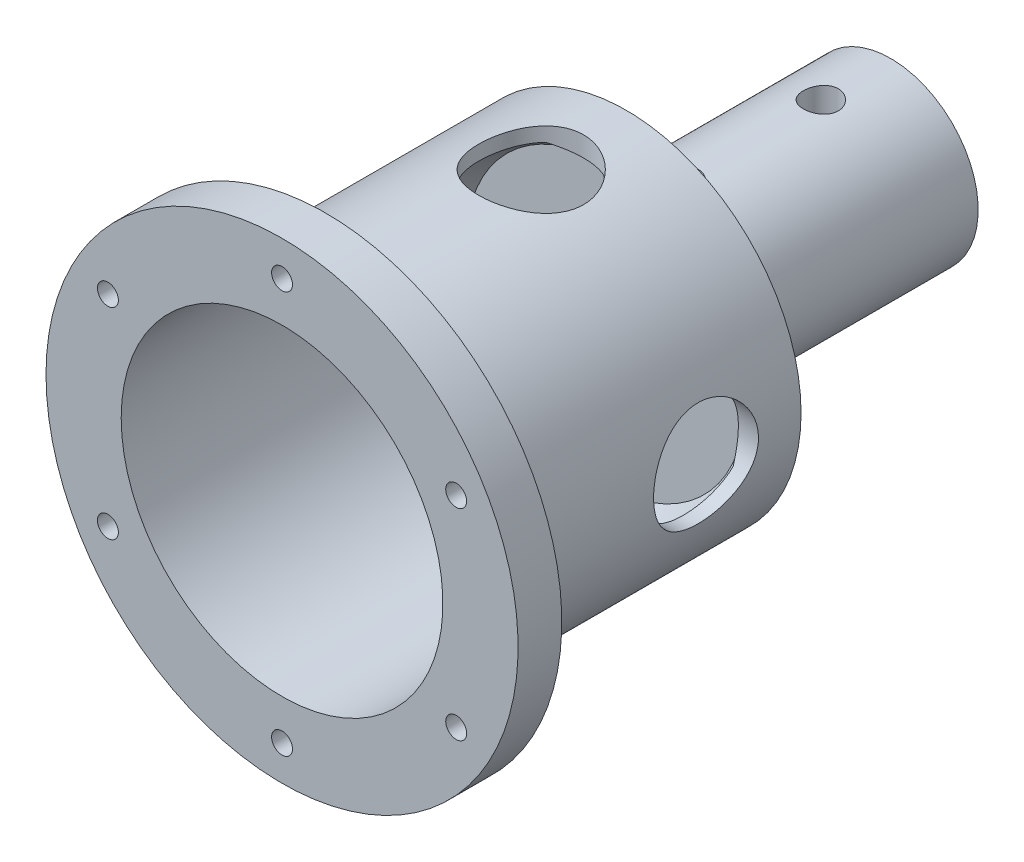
SolidWorks part; units mm, degrees
ref_plane "Front" through (0, 0, 0) normal (0, 0, 1) x (1, 0, 0)
ref_plane "Top" through (0, 0, 0) normal (0, 1, 0) x (1, 0, 0)
ref_plane "Right" through (0, 0, 0) normal (1, 0, 0) x (0, 0, -1)
sketch "Sketch1" plane through (0, 0, 0) normal (1, 0, 0) x (0, 0, -1)
  line L0 (0, 29.21) -> (53.175, 29.21)
  line L1 (53.175, 29.21) -> (58.7375, 25.3151)
  line L2 (58.7375, 25.3151) -> (58.7375, 8.7313)
  line L3 (0, 29.21) -> (0, 42.8625)
  line L4 (0, 42.8625) -> (7.9375, 42.8625)
  line L5 (7.9375, 42.8625) -> (7.9375, 31.75)
  line L6 (7.9375, 31.75) -> (62.5, 31.75)
  line L7 (62.5, -15.875) -> (110.534, -15.875) construction
  line L8 (110.534, 15.875) -> (110.534, 8.7313)
  line L9 (110.534, 8.7313) -> (58.7375, 8.7313)
  line L10 (0, 0) -> (-25.3858, 0) construction
  line L11 (0, -29.21) -> (53.175, -29.21) construction
  line L12 (7.9375, -31.75) -> (62.5, -31.75) construction
  line L13 (0, -42.8625) -> (7.9375, -42.8625) construction
  line L14 (110.534, -8.7312) -> (58.7375, -8.7312) construction
  line L15 (62.5, 31.75) -> (62.5, 15.875)
  line L16 (62.5, 15.875) -> (110.534, 15.875)
  dimension "D1" = 58.42
  dimension "D2" = 53.175
  dimension "D3" = 63.5
  dimension "D4" = 35
  dimension "D5" = 58.7375
  dimension "D6" = 110.534
  dimension "D7" = 31.75
  dimension "D8" = 85.725
  dimension "D9" = 17.4625
  dimension "D10" = 62.5
  dimension "D11" = 7.9375
revolve "Revolve1" add sketch "Sketch1" angle 360 about L10
sketch "Sketch2" plane through (0, 0, -110.534) normal (0, 0, -1) x (-1, 0, 0)
  circle A0 centre (0, 0) radius 10.9004
  dimension "D1" = 21.8008
extrude "Extrude1" cut sketch "Sketch2" against normal blind 48.304
sketch "Sketch3" plane through (0, 0, 0) normal (1, 0, 0) x (0, 0, -1)
  circle A0 centre (45.2438, 0) radius 9.525
  dimension "D1" = 19.05
  dimension "D2" = 45.2438
extrude "Cut-Extrude1" cut sketch "Sketch3" against normal through all and the other way through all
sketch "Sketch4" plane through (0, 0, 0) normal (0, 1, 0) x (1, 0, 0)
  circle A0 centre (0, 45.2438) radius 9.525
  dimension "D1" = 19.05
  dimension "D2" = 45.2438
extrude "Extrude2" cut sketch "Sketch4" against normal through all and the other way through all
hole_wizard "CBORE for #6 Socket Head Cap Screw1" positions "Sketch6" profile "Sketch5" counterbore size "#6" standard "Ansi Inch"
sketch "Sketch6" plane through (0, 0, -7.9375) normal (0, 0, -1) x (-1, 0, 0)
  circle A0 centre (0, 0) radius 36.5125 construction
  point P0 (0, 36.5125)
  point P14 (31.6208, 18.2563)
  point P15 (31.6208, -18.2562)
  point P16 (0, -36.5125)
  point P17 (-31.6208, -18.2563)
  point P18 (-31.6208, 18.2563)
  dimension "D1" = 73.025
sketch "Sketch5" plane through (0, 36.5125, -7.9375) normal (1, 0, 0) x (0, 1, 0)
  line L0 (0, 0) -> (0, 7.9375)
  line L1 (0, 7.9375) -> (1.8986, 7.9375)
  line L3 (1.8986, 7.9375) -> (1.8986, 3.5052)
  line L4 (1.8986, 3.5052) -> (3.5725, 3.5052)
  line L5 (3.5725, 3.5052) -> (3.5725, 0)
  line L7 (3.5725, 0) -> (0, 0)
  line L11 (0, -6.35) -> (0, 107.95) construction
  dimension "Thru Hole Dia." = 3.7973
  dimension "Thru Hole Depth" = 7.9375
  dimension "C'Bore Dia." = 7.145
  dimension "C'Bore Depth" = 3.5052
sketch "Sketch7" plane through (0, 0, 0) normal (1, 0, 0) x (0, 0, -1)
  line L0 (110.534, 10.9004) -> (62.23, 10.9004) construction
  line L1 (109.3226, 10.9004) -> (108.2226, 10.9004)
  line L2 (109.3226, 10.9004) -> (109.3226, 11.5)
  line L3 (109.3226, 11.5) -> (108.2226, 11.5)
  line L4 (108.2226, 10.9004) -> (108.2226, 11.5)
  line L5 (0, 0) -> (-6.9287, 0) construction
  line L6 (109.3226, -11.5) -> (108.2226, -11.5) construction
  line L7 (62.23, -10.9004) -> (62.23, 10.9004) construction
  dimension "D1" = 23
  dimension "D2" = 1.1
  dimension "D3" = 45.9926
revolve "Cut-Revolve1" cut sketch "Sketch7" angle 360 about L5
sketch "Sketch8" plane through (0, 0, 0) normal (0, 1, 0) x (1, 0, 0)
  line L0 (15.875, 110.534) -> (-15.875, 110.534) construction
  circle A0 centre (0, 97.834) radius 3.175
  circle A1 centre (0, 72.434) radius 3.175
  dimension "D3" = 6.35
  dimension "D1" = 12.7
  dimension "D2" = 38.1
extrude "Cut-Extrude2" cut sketch "Sketch8" against normal through all and the other way through all
fillet "Fillet1" radius 4.5875 1 edges at (-15.875, 0, -62.5)
sketch3d "CenterOfMass 10/16/2008 14:00:48"
  point P0 (-0.0006, -0.0001, -30.4782)
